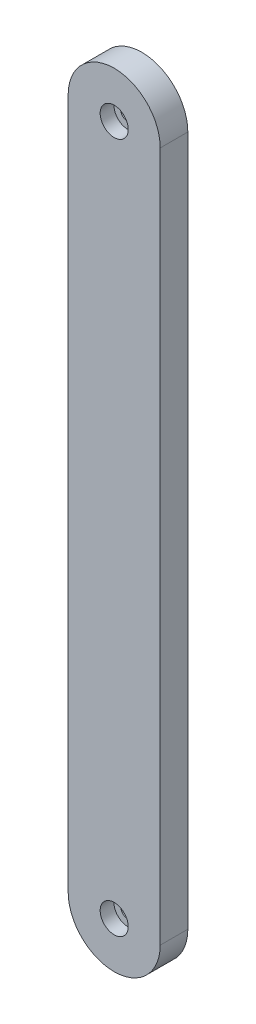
SolidWorks part; units mm, degrees
ref_plane "Front Plane" through (0, 0, 0) normal (0, 0, 1) x (1, 0, 0)
ref_plane "Top Plane" through (0, 0, 0) normal (0, 1, 0) x (1, 0, 0)
ref_plane "Right Plane" through (0, 0, 0) normal (1, 0, 0) x (0, 0, -1)
sketch "Sketch1" plane through (0, 0, 0) normal (0, 0, 1) x (1, 0, 0)
  line L0 (0, 0) -> (0, 150) construction
  line L1 (-10, 0) -> (-10, 150)
  line L2 (10, 0) -> (10, 150)
  arc A0 (-10, 0) -> (10, 0) centre (0, 0) ccw
  arc A1 (10, 150) -> (-10, 150) centre (0, 150) ccw
  circle A2 centre (0, 0) radius 1.6
  circle A3 centre (0, 150) radius 1.6
  point P3 (0, 75)
  dimension "D3" = 3.2
  dimension "D4" = 3.2
  dimension "D1" = 20
  dimension "D2" = 150
extrude "Boss-Extrude1" add sketch "Sketch1" along normal blind 6
sketch "Sketch2" plane through (0, 0, 6) normal (0, 0, 1) x (1, 0, 0)
  circle A0 centre (0, 150) radius 3.05
  circle A1 centre (0, 0) radius 3.05
  dimension "D1" = 6.1
  dimension "D2" = 6.1
extrude "Cut-Extrude1" cut sketch "Sketch2" against normal blind 3
